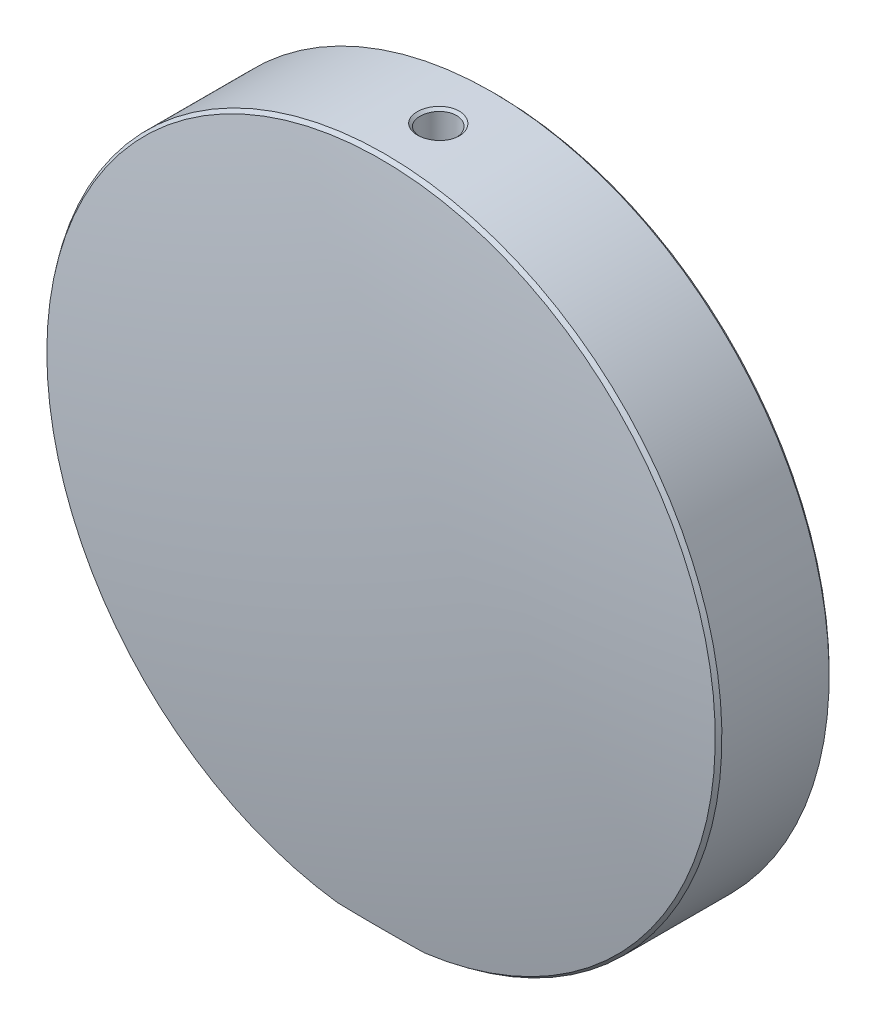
SolidWorks part; units mm, degrees
ref_plane "Спереди" through (0, 0, 0) normal (0, 0, 1) x (1, 0, 0)
ref_plane "Сверху" through (0, 0, 0) normal (0, 1, 0) x (1, 0, 0)
ref_plane "Справа" through (0, 0, 0) normal (1, 0, 0) x (0, 0, -1)
sketch "Эскиз1" plane through (0, 0, 0) normal (0, 1, 0) x (1, 0, 0)
  line L0 (0, 15) -> (0, -15)
  line L1 (-104.2833, 0) -> (104.2833, 0) construction
  line L2 (-60, -10.1027) -> (-60, 10.1027)
  arc A0 (-60, -10.1027) -> (0, -15) centre (0, 355) ccw
  arc A1 (-60, 10.1027) -> (0, 15) centre (0, -355) cw
  point P10 (-60, 0)
  dimension "D2" = 740
  dimension "D1" = 30
  dimension "D3" = 60
revolve "Повернуть1" add sketch "Эскиз1" angle 360 about L0
sketch "Эскиз2" plane through (0, 0, 0) normal (0, 0, 1) x (1, 0, 0)
  line L0 (-10.9087, -59) -> (10.9087, -59)
  line L1 (-10.9087, -59) -> (-10.9087, -62.828)
  line L2 (-10.9087, -62.828) -> (10.9087, -62.828)
  line L3 (10.9087, -62.828) -> (10.9087, -59)
  circle A0 centre (0, 0) radius 60 construction
  dimension "D1" = 59
extrude "Вырез-Вытянуть1" cut sketch "Эскиз2" against normal mid plane 30
sketch "Эскиз3" plane through (0, 0, 0) normal (0, 1, 0) x (1, 0, 0)
  circle A0 centre (0, 0) radius 3.25
  dimension "D1" = 6.5
extrude "Вырез-Вытянуть2" cut sketch "Эскиз3" against normal mid plane 120
chamfer "Фаска1" distance 0.5 angle 45 4 edges at (0, -59, 3.25) (-0.7422, 59.9954, -3.1641) (0, 60, -10.1027) (0, 60, 10.1027)
